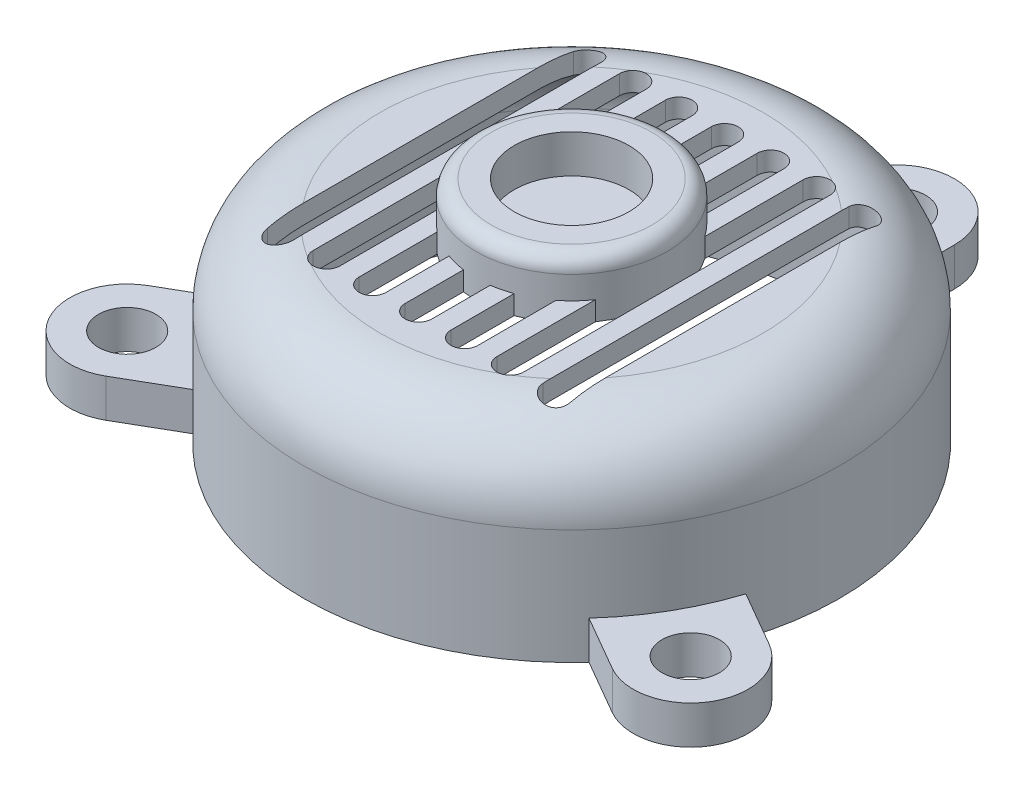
SolidWorks part; units mm, degrees
ref_plane "Front Plane" through (0, 0, 0) normal (0, 0, 1) x (1, 0, 0)
ref_plane "Top Plane" through (0, 0, 0) normal (0, 1, 0) x (1, 0, 0)
ref_plane "Right Plane" through (0, 0, 0) normal (1, 0, 0) x (0, 0, -1)
sketch "Sketch1" plane through (0, 0, 0) normal (0, 0, 1) x (1, 0, 0)
  line L0 (0, 49.8495) -> (0, 0) construction
  line L1 (0, 0) -> (0, 25)
  line L2 (0, 25) -> (25, 25)
  line L3 (35, 15) -> (35, 0)
  line L4 (35, 0) -> (0, 0)
  arc A0 (25, 25) -> (35, 15) centre (25, 15) cw
  dimension "D1" = 10
  dimension "D2" = 70
  dimension "D3" = 25
revolve "Revolve1" add sketch "Sketch1" angle 360 about L0
shell "Shell1" thickness 2.5
sketch "Sketch2" plane through (0, 0, 0) normal (0, 1, 0) x (1, 0, 0)
  line L0 (0, 0) -> (0, 42.5) construction
  line L1 (-7.5, 42.5) -> (-7.5, 34.187)
  line L3 (7.5, 34.187) -> (7.5, 42.5)
  circle A0 centre (0, 0) radius 35 construction
  arc A1 (7.5, 34.187) -> (-7.5, 34.187) centre (0, 0) ccw
  arc A2 (-7.5, 42.5) -> (7.5, 42.5) centre (0, 42.5) cw
  circle A3 centre (0, 42.5) radius 3.75
  dimension "D2" = 7.5
  dimension "D3" = 7.5
  dimension "D1" = 42.5
extrude "Boss-Extrude1" add sketch "Sketch2" along normal blind 5
pattern_circular "CirPattern1" count 6 over 360 about axis through (0, 0, 0) along (0, 1, 0) of "Boss-Extrude1"
sketch "Sketch5" plane through (0, 25, 0) normal (0, 1, 0) x (1, 0, 0)
  line L0 (-18, 20) -> (-18, -20) construction
  line L1 (-16.25, 20) -> (-16.25, -20)
  line L2 (-19.75, 20) -> (-19.75, -20)
  arc A0 (-16.25, 20) -> (-19.75, 20) centre (-18, 20) ccw
  arc A1 (-19.75, -20) -> (-16.25, -20) centre (-18, -20) ccw
  point P2 (-18, 0)
  dimension "D2" = 1.75
  dimension "D1" = 40
  dimension "D3" = 18
extrude "Cut-Extrude2" cut sketch "Sketch5" against normal up to next
pattern_linear "LPattern1" count 7 spacing 6 along (1, 0, 0) of "Cut-Extrude2"
sketch "Sketch3" plane through (0, 22.5, 0) normal (0, 1, 0) x (1, 0, 0)
  circle A0 centre (0, 0) radius 12.5
  dimension "D1" = 25
extrude "Boss-Extrude2" add sketch "Sketch3" along normal blind 7.5
sketch "Sketch4" plane through (0, 30, 0) normal (0, 1, 0) x (1, 0, 0)
  circle A0 centre (0, 0) radius 7.5
  dimension "D1" = 15
extrude "Cut-Extrude1" cut sketch "Sketch4" against normal blind 5
fillet "Fillet1" radius 2 1 edges at (0, 30, 12.5)
